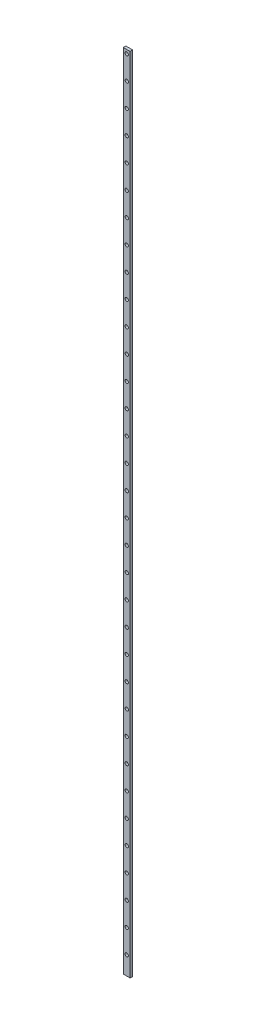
SolidWorks part; units mm, degrees
ref_plane "Alzado" through (0, 0, 0) normal (0, 0, 1) x (1, 0, 0)
ref_plane "Planta" through (0, 0, 0) normal (0, 1, 0) x (1, 0, 0)
ref_plane "Vista lateral" through (0, 0, 0) normal (1, 0, 0) x (0, 0, -1)
sketch "Croquis1" plane through (0, 0, 0) normal (0, 0, 1) x (1, 0, 0)
  line L0 (-12.7, 0) -> (-12.7, -1500)
  line L1 (-12.7, -1500) -> (0, -1500)
  line L2 (0, -1500) -> (0, 0)
  line L3 (0, 0) -> (-12.7, 0)
  dimension "D1" = 12.7
  dimension "D2" = 1500
extrude "Saliente-Extruir1" add sketch "Croquis1" along normal blind 4.8
sketch "Croquis2" plane through (0, 0, 4.8) normal (0, 0, 1) x (1, 0, 0)
  line L0 (-12.7, -1500) -> (0, -1500) construction
  line L1 (0, -1500) -> (0, 0) construction
  circle A0 centre (-6.35, -1465.65) radius 3.15
  dimension "D2" = 6.3
  dimension "D1" = 34.35
  dimension "D3" = 6.35
extrude "Cortar-Extruir1" cut sketch "Croquis2" against normal through all
pattern_linear "MatrizL1" count 34 spacing 44.2 along (0, 1, 0) of "Cortar-Extruir1"
